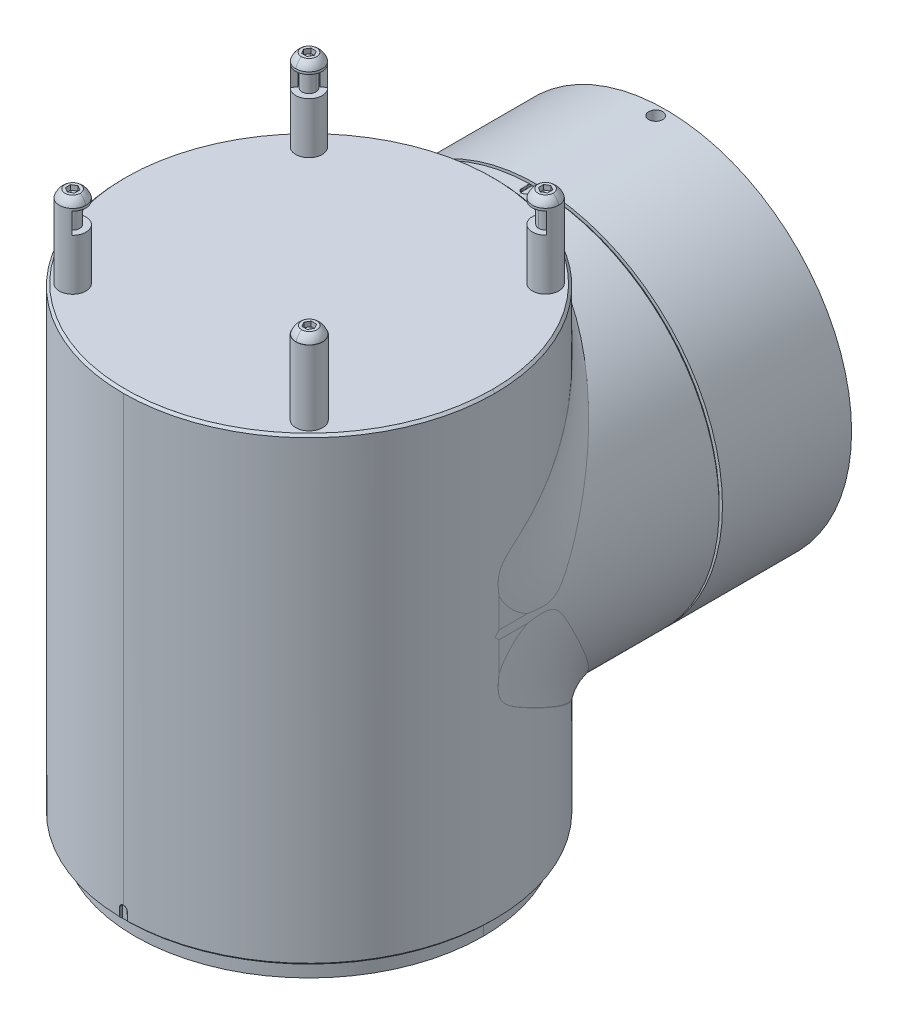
SolidWorks part; units mm, degrees
ref_plane "前视基准面" through (0, 0, 0) normal (0, 0, 1) x (1, 0, 0)
ref_plane "上视基准面" through (0, 0, 0) normal (0, 1, 0) x (1, 0, 0)
ref_plane "右视基准面" through (0, 0, 0) normal (1, 0, 0) x (0, 0, -1)
imported_body "8.0.00.8012243-1-solid1"
imported_body "14关节1-1-solid1"
sketch "草图1" plane through (0, 0, 40.0009) normal (0, 0, -1) x (-1, 0, 0)
  circle A0 centre (-42.7327, 43.7301) radius 37.5
extrude "凸台-拉伸1" add sketch "草图1" against normal blind 70
ref_plane "基准面1" through (0, 120, 0) normal (0, 1, 0) x (1, 0, 0)
sketch "草图2" plane through (0, 120, 0) normal (0, 1, 0) x (1, 0, 0)
  circle A0 centre (42.7327, -113.0009) radius 47.654
  circle A1 centre (17.2917, -138.4716) radius 2.85
  circle A2 centre (17.262, -87.5599) radius 2.85
  circle A3 centre (68.1737, -87.5302) radius 2.85
  circle A6 centre (68.2034, -138.4419) radius 2.9035
extrude "切除-拉伸1" cut sketch "草图2" against normal up to surface (30.2699 mm away)
